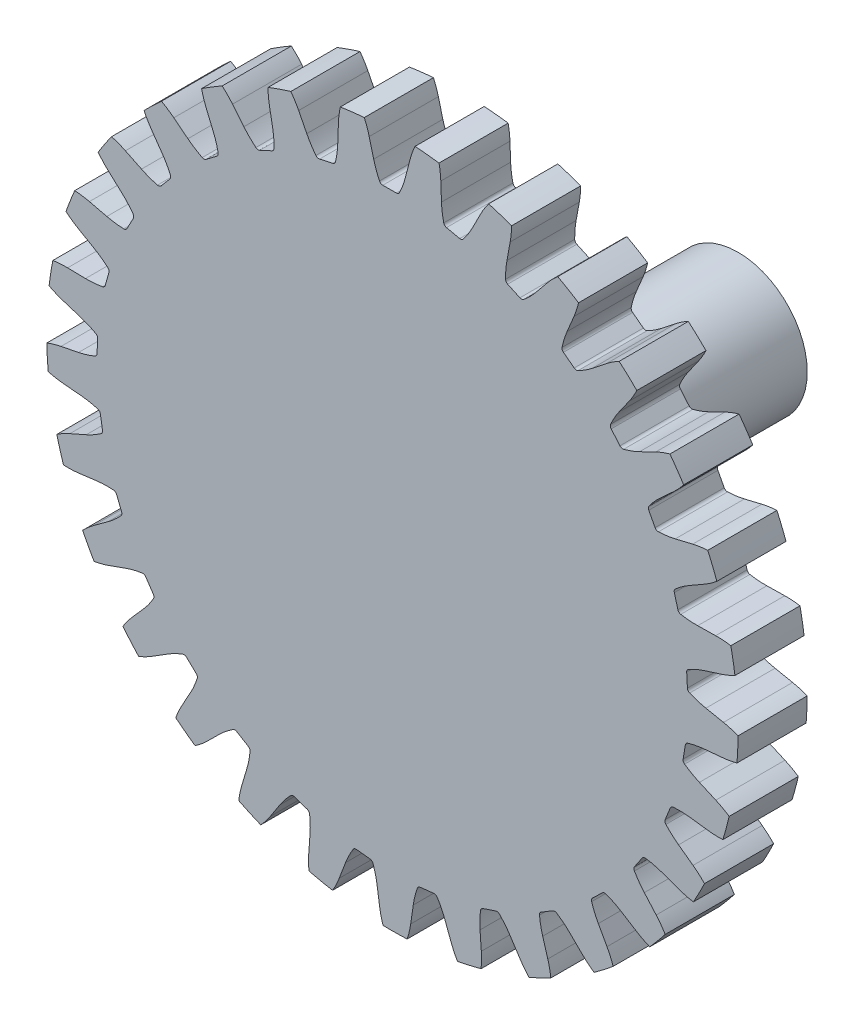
SolidWorks part; units mm, degrees
ref_plane "Front" through (0, 0, 0) normal (0, 0, 1) x (1, 0, 0)
ref_plane "Top" through (0, 0, 0) normal (0, 1, 0) x (1, 0, 0)
ref_plane "Right" through (0, 0, 0) normal (1, 0, 0) x (0, 0, -1)
sketch "Sketch1" plane through (0, 0, 0) normal (0, 0, 1) x (1, 0, 0)
  line L0 (0, 0) -> (0, 63.5) construction
  circle A1 centre (0, 0) radius 63.5
  dimension "D1" = 127
extrude "Extrude1" add sketch "Sketch1" along normal blind 12.7
sketch "Sketch2" plane through (0, 0, 12.7) normal (0, 0, 1) x (1, 0, 0)
  line L0 (0, 0) -> (0, 31.75) construction
  line L1 (3.7322, 29.8519) -> (3.81, 30.3599)
  line L2 (-3.7322, 29.8519) -> (-3.81, 30.3599)
  circle A0 centre (0, 0) radius 63.5 construction
  arc A1 (1.905, 24.0099) -> (-1.905, 24.0099) centre (0, 0) ccw
  arc A2 (1.905, 24.0099) -> (3.7322, 29.8519) centre (-16.3537, 32.9275) ccw
  arc A3 (3.81, 30.3599) -> (4.0769, 31.4872) centre (10.922, 29.2709) cw
  arc A4 (-3.81, 30.3599) -> (-4.0769, 31.4872) centre (-10.922, 29.2709) ccw
  arc A5 (-1.905, 24.0099) -> (-3.7322, 29.8519) centre (16.3537, 32.9275) cw
  dimension "D1" = 7.62
  dimension "D2" = 20.32
  dimension "D4" = 6.35
  dimension "D5" = 3.81
  dimension "D3" = 0.508
extrude "Cut-Extrude1" cut sketch "Sketch2" against normal through all and the other way through all flip side to cut
fillet "Fillet1" radius 0.635
pattern_circular "CirPattern1" count 31 over 360
pattern_circular "CirPattern2" count 16 over 360
sketch "Sketch3" plane through (0, 0, 0) normal (0, 0, -1) x (-1, 0, 0)
  circle A0 centre (0, 0) radius 12.7
  dimension "D1" = 25.4
extrude "Extrude2" add sketch "Sketch3" along normal blind 50.8
sketch "Sketch4" plane through (-0.5363, -17.3542, 12.7) normal (0, 0, 1) x (1, 0, 0)
  line L2 (-1.2213, 71.5867) -> (1.2586, 71.5867)
  line L5 (2.9317, 74.8923) -> (3.7553, 78.077)
  line L7 (-2.8944, 74.8923) -> (-3.718, 78.077)
  line L11 (6.5556, 74.8351) -> (0.4659, 74.8351) construction
  line L14 (0.6035, 77.7923) -> (7.0068, 77.7923) construction
  circle A0 centre (0.5363, 17.3542) radius 63.5 construction
  arc A3 (4.6939, 80.718) -> (3.7553, 78.077) centre (19.1247, 74.1022) ccw
  arc A4 (1.8571, 71.9622) -> (2.9317, 74.8923) centre (-12.4376, 78.8671) ccw
  arc A7 (1.2586, 71.5867) -> (1.8571, 71.9622) centre (1.2586, 72.2513) ccw
  arc A8 (-1.2213, 71.5867) -> (-1.8197, 71.9622) centre (-1.2213, 72.2513) cw
  arc A9 (-1.8197, 71.9622) -> (-2.8944, 74.8923) centre (12.475, 78.8671) cw
  arc A10 (-4.6566, 80.718) -> (-3.718, 78.077) centre (-19.0873, 74.1022) cw
  point P2 (0.0187, 80.718)
  point P7 (3.3435, 76.4847)
  point P9 (-3.3249, 76.2)
  point P13 (0, 76.2)
  point P50 (0.0187, 71.5867)
  dimension "D5" = 0.6646
  dimension "D2" = 15.875
extrude "Cut-Extrude2" cut sketch "Sketch4" against normal through all flip side to cut
pattern_circular "CirPattern3" count 29 over 360 about axis through (0, 0, 0) along (0, 0, 1) of "Cut-Extrude2"
